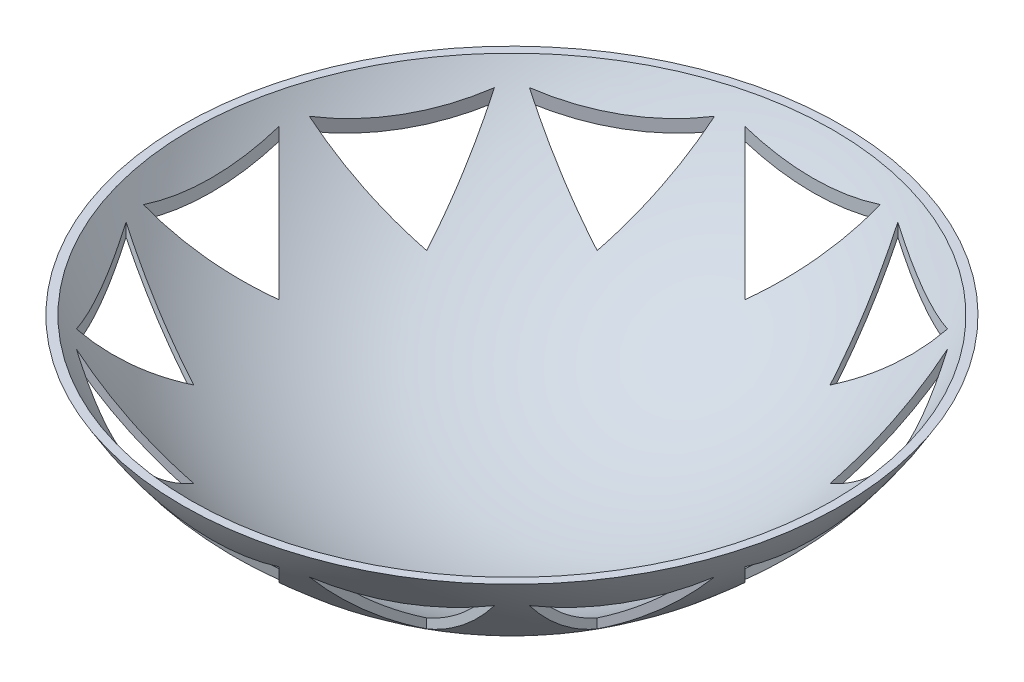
SolidWorks part; units mm, degrees
ref_plane "Front Plane" through (0, 0, 0) normal (0, 0, 1) x (1, 0, 0)
ref_plane "Top Plane" through (0, 0, 0) normal (0, 1, 0) x (1, 0, 0)
ref_plane "Right Plane" through (0, 0, 0) normal (1, 0, 0) x (0, 0, -1)
sketch "Sketch1" plane through (0, 0, 0) normal (0, 0, 1) x (1, 0, 0)
  line L1 (43.3013, -25) -> (44.4522, -25)
  line L2 (0, 0) -> (0, -50) construction
  line L3 (0, -50) -> (0, -51)
  arc A0 (0, -50) -> (43.3013, -25) centre (0, 0) ccw
  arc A1 (0, -51) -> (44.4522, -25) centre (0, 0) ccw
  circle A2 centre (0, 0) radius 51 construction
  circle A3 centre (0, 0) radius 50 construction
  dimension "D1" = 100
  dimension "D3" = 25
  dimension "D2" = 1
revolve "Revolve4" add sketch "Sketch1" angle 360 about L2
sketch "Sketch2" plane through (0, 0, 0) normal (0, 1, 0) x (1, 0, 0)
  circle A0 centre (0, 0) radius 0.0005
  dimension "D1" = 0.001
extrude "Extrude1" cut sketch "Sketch2" against normal through all
sketch "Sketch3" plane through (0, 0, 0) normal (0, 1, 0) x (1, 0, 0)
  line L0 (31.4129, 0) -> (41.5702, 0) construction
  line L1 (31.4129, 0) -> (40.5529, 9.1401)
  line L2 (31.4129, 0) -> (40.5529, -9.1401)
  line L3 (40.5529, 9.1401) -> (40.5529, -9.1401)
  line L4 (27.2043, -15.7064) -> (39.6899, -12.3609)
  line L5 (27.2043, -15.7064) -> (30.5498, -28.192)
  line L6 (39.6899, -12.3609) -> (30.5498, -28.192)
  line L7 (15.7064, -27.2043) -> (28.192, -30.5498)
  line L8 (15.7064, -27.2043) -> (12.3609, -39.6899)
  line L9 (28.192, -30.5498) -> (12.3609, -39.6899)
  line L10 (0, -31.4129) -> (9.1401, -40.5529)
  line L11 (0, -31.4129) -> (-9.1401, -40.5529)
  line L12 (9.1401, -40.5529) -> (-9.1401, -40.5529)
  line L13 (-15.7064, -27.2043) -> (-12.3609, -39.6899)
  line L14 (-15.7064, -27.2043) -> (-28.192, -30.5498)
  line L15 (-12.3609, -39.6899) -> (-28.192, -30.5498)
  line L16 (-27.2043, -15.7064) -> (-30.5498, -28.192)
  line L17 (-27.2043, -15.7064) -> (-39.6899, -12.3609)
  line L18 (-30.5498, -28.192) -> (-39.6899, -12.3609)
  line L19 (-31.4129, 0) -> (-40.5529, -9.1401)
  line L20 (-31.4129, 0) -> (-40.5529, 9.1401)
  line L21 (-40.5529, -9.1401) -> (-40.5529, 9.1401)
  line L22 (-27.2043, 15.7064) -> (-39.6899, 12.3609)
  line L23 (-27.2043, 15.7064) -> (-30.5498, 28.192)
  line L24 (-39.6899, 12.3609) -> (-30.5498, 28.192)
  line L25 (-15.7064, 27.2043) -> (-28.192, 30.5498)
  line L26 (-15.7064, 27.2043) -> (-12.3609, 39.6899)
  line L27 (-28.192, 30.5498) -> (-12.3609, 39.6899)
  line L28 (0, 31.4129) -> (-9.1401, 40.5529)
  line L29 (0, 31.4129) -> (9.1401, 40.5529)
  line L30 (-9.1401, 40.5529) -> (9.1401, 40.5529)
  line L31 (15.7064, 27.2043) -> (12.3609, 39.6899)
  line L32 (15.7064, 27.2043) -> (28.192, 30.5498)
  line L33 (12.3609, 39.6899) -> (28.192, 30.5498)
  line L34 (27.2043, 15.7064) -> (30.5498, 28.192)
  line L35 (27.2043, 15.7064) -> (39.6899, 12.3609)
  line L36 (30.5498, 28.192) -> (39.6899, 12.3609)
  circle A0 centre (0, 0) radius 41.5702 construction
  circle A1 centre (0, 0) radius 31.4129 construction
extrude "Extrude2" cut sketch "Sketch3" against normal through all
